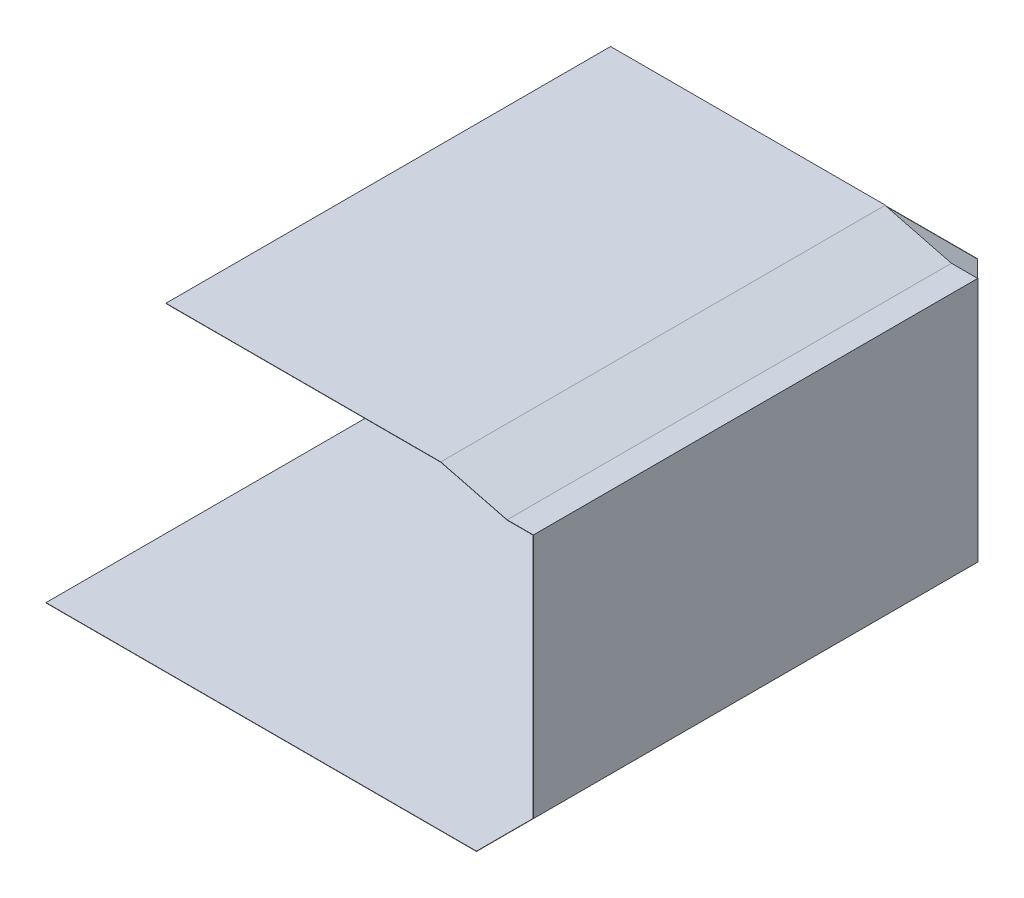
SolidWorks part; units mm, degrees
ref_plane "Front Plane" through (0, 0, 0) normal (0, 0, 1) x (1, 0, 0)
ref_plane "Top Plane" through (0, 0, 0) normal (0, 1, 0) x (1, 0, 0)
ref_plane "Right Plane" through (0, 0, 0) normal (1, 0, 0) x (0, 0, -1)
sketch "Sketch1" plane through (0, 0, 0) normal (0, 0, 1) x (1, 0, 0)
  line L0 (-2477.6476, 172.3298) -> (-217.0476, 172.3298)
  line L1 (-217.0476, 172.3298) -> (329.0524, 32.6298)
  line L2 (329.0524, 32.6298) -> (544.9524, 32.6298)
  line L3 (-2477.6476, 169.7898) -> (-217.3673, 169.7898)
  line L4 (-217.3673, 169.7898) -> (328.7327, 30.0898)
  line L5 (328.7327, 30.0898) -> (544.9524, 30.0898)
  line L6 (-2477.6476, 172.3298) -> (-2477.6476, 169.7898)
  line L7 (544.9524, 32.6298) -> (544.9524, 30.0898)
  dimension "D1" = 215.9
  dimension "D2" = 546.1
  dimension "D3" = 139.7
  dimension "D4" = 2260.6
  dimension "D5" = 2.54
extrude "Boss-Extrude1" add sketch "Sketch1" along normal blind 3657.6
sketch "Sketch2" plane through (0, 30.0898, 0) normal (0, -1, 0) x (1, 0, 0)
  line L0 (328.7327, 0) -> (544.9524, 0) construction
  line L1 (544.9524, 3657.6) -> (542.4124, 3657.6)
  line L2 (544.9524, 3657.6) -> (544.9524, 0)
  line L3 (544.9524, 0) -> (542.4124, 0)
  line L4 (542.4124, 3657.6) -> (542.4124, 0)
  dimension "D1" = 2.54
extrude "Boss-Extrude2" add sketch "Sketch2" along normal blind 2016.125
sketch "Sketch3" plane through (0, -1986.0352, 0) normal (0, -1, 0) x (1, 0, 0)
  line L1 (542.4124, 0) -> (-2477.6476, 0)
  line L2 (542.4124, 0) -> (542.4124, 2.54)
  line L3 (542.4124, 2.54) -> (-2477.6476, 2.54)
  line L4 (-2477.6476, 0) -> (-2477.6476, 2.54)
  dimension "D1" = 2.54
extrude "Boss-Extrude3" add sketch "Sketch3" along direction (0, 1, 0) on the side against the normal up to surface (2155.825 mm away) contours L4 L1 L3 M4
sketch "Sketch4" plane through (0, -1986.0352, 0) normal (0, -1, 0) x (1, 0, 0)
  line L1 (544.9524, 0) -> (-2996.4616, 0)
  line L2 (544.9524, 0) -> (544.9524, 4125.5896)
  line L3 (544.9524, 4125.5896) -> (-2996.4616, 4125.5896)
  line L4 (-2996.4616, 0) -> (-2996.4616, 4125.5896)
extrude "Boss-Extrude4" add sketch "Sketch4" along normal blind 2.54
